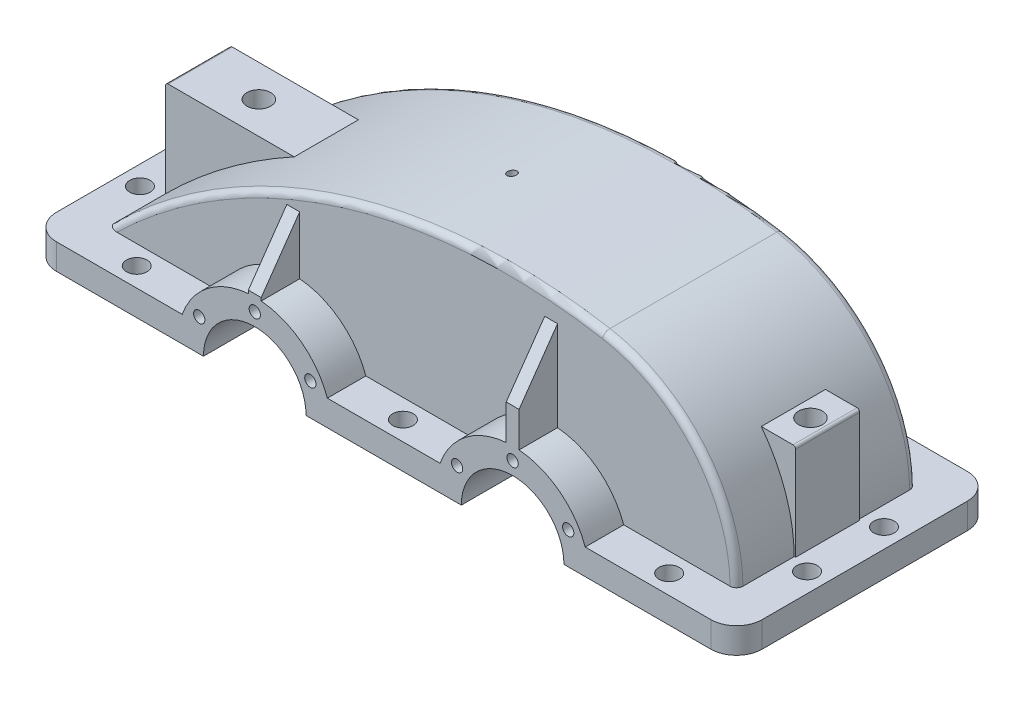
SolidWorks part; units mm, degrees
ref_plane "Front" through (0, 0, 0) normal (0, 0, 1) x (1, 0, 0)
ref_plane "Top" through (0, 0, 0) normal (0, 1, 0) x (1, 0, 0)
ref_plane "Right" through (0, 0, 0) normal (1, 0, 0) x (0, 0, -1)
sketch "Sketch4" plane through (0, 0, 0) normal (0, 0, 1) x (1, 0, 0)
  line L0 (0, 0) -> (490, 0)
  line L1 (0, 0) -> (0, 285.887) construction
  arc A0 (0, 0) -> (386.4319, 122.2359) centre (311.0033, -311.2506) cw
  arc A1 (386.4319, 122.2359) -> (490, 0) centre (365.0033, -0.9137) cw
  dimension "D1" = 440
  dimension "D3" = 125
  dimension "D2" = 490
  dimension "D4" = 54
extrude "Boss-Extrude4" add sketch "Sketch4" along normal blind 140
shell "Shell2" thickness 10
sketch "Sketch6" plane through (0, 0, 0) normal (0, -1, 0) x (1, 0, 0)
  line L0 (0, 0) -> (490, 0) construction
  line L1 (-30, 170) -> (520, 170)
  line L2 (-30, 170) -> (-30, -30)
  line L3 (-30, -30) -> (520, -30)
  line L4 (520, 170) -> (520, -30)
  line L5 (479.9997, 130) -> (479.9997, 10) construction
  line L6 (14.3165, 10) -> (479.9997, 10) construction
  line L7 (14.3165, 130) -> (14.3165, 10) construction
  line L8 (14.3165, 130) -> (479.9997, 130) construction
  line L9 (479.9997, 130) -> (479.9997, 10)
  line L10 (14.3165, 10) -> (479.9997, 10)
  line L11 (14.3165, 130) -> (14.3165, 10)
  line L12 (14.3165, 130) -> (479.9997, 130)
  dimension "D1" = 550
  dimension "D2" = 200
  dimension "D3" = 30
  dimension "D4" = 30
extrude "Boss-Extrude5" add sketch "Sketch6" along normal blind 20
sketch "Sketch7" plane through (0, 0, 170) normal (0, 0, 1) x (1, 0, 0)
  line L0 (520, -20) -> (-30, -20) construction
  line L1 (84.5, -20) -> (104.5, -20)
  line L2 (184.5, -20) -> (204.5, -20)
  line L3 (285.5, -20) -> (305.5, -20)
  line L4 (385.5, -20) -> (405.5, -20)
  arc A0 (204.5, -20) -> (84.5, -20) centre (144.5, -20) ccw
  arc A1 (184.5, -20) -> (104.5, -20) centre (144.5, -20) ccw
  arc A2 (405.5, -20) -> (285.5, -20) centre (345.5, -20) ccw
  arc A3 (385.5, -20) -> (305.5, -20) centre (345.5, -20) ccw
  dimension "D2" = 40
  dimension "D3" = 60
  dimension "D1" = 174.5
  dimension "D4" = 201
extrude "Boss-Extrude6" add sketch "Sketch7" against normal up to next
ref_plane "Plane2" through (0, 0, 70) normal (0, 0, 1) x (1, 0, 0)
mirror "Mirror1" about plane through (0, 0, 70) normal (0, 0, 1) of "Boss-Extrude6"
sketch "Sketch8" plane through (0, 0, 170) normal (0, 0, 1) x (1, 0, 0)
  circle A0 centre (144.5, -20) radius 40
  arc A1 (179.141, 0) -> (109.859, 0) centre (144.5, -20) ccw construction
  circle A2 centre (345.5, -20) radius 40
  arc A3 (380.141, 0) -> (310.859, 0) centre (345.5, -20) ccw construction
extrude "Cut-Extrude2" cut sketch "Sketch8" against normal blind 259
ref_plane "Plane4" through (0, 85, 0) normal (0, -1, 0) x (-1, 0, 0)
sketch "Sketch12" plane through (0, 85, 0) normal (0, -1, 0) x (-1, 0, 0)
  line L0 (-144.5, -170) -> (-144.5, -140) construction
  line L1 (-149.5, 30) -> (-139.5, 30)
  line L2 (-149.5, 30) -> (-149.5, 0)
  line L4 (-139.5, 30) -> (-139.5, 0)
  line L6 (-149.5, -140) -> (-149.5, -170)
  line L7 (-149.5, -170) -> (-139.5, -170)
  line L8 (-139.5, -140) -> (-139.5, -170)
  line L9 (-184.5, -170) -> (-104.5, -170) construction
  line L13 (-104.5, 30) -> (-184.5, 30) construction
  line L14 (-201.0685, -140) -> (-87.9315, -140) construction
  line L15 (-87.9315, 0) -> (-201.0685, 0) construction
  line L16 (-149.5, -140) -> (-139.5, -140)
  line L17 (-139.5, 0) -> (-149.5, 0)
  line L18 (-144.5, 0) -> (-144.5, 118.5487) construction
  dimension "D1" = 10
extrude "Boss-Extrude8" add sketch "Sketch12" along normal up to surface (45.2087 mm away)
ref_plane "Plane5" through (0, 110, 0) normal (0, -1, 0) x (-1, 0, 0)
sketch "Sketch13" plane through (0, 110, 0) normal (0, -1, 0) x (-1, 0, 0)
  line L0 (-345.5, -170) -> (-345.5, -140) construction
  line L1 (-350.5, 30) -> (-340.5, 30)
  line L2 (-350.5, 30) -> (-350.5, 0)
  line L3 (-350.5, -170) -> (-340.5, -170)
  line L4 (-340.5, 30) -> (-340.5, 0)
  line L5 (-385.5, -170) -> (-305.5, -170) construction
  line L6 (-305.5, 30) -> (-385.5, 30) construction
  line L11 (-288.9315, 0) -> (-402.0685, 0) construction
  line L12 (-402.0685, -140) -> (-288.9315, -140) construction
  line L13 (-340.5, 0) -> (-350.5, 0)
  line L14 (-350.5, -140) -> (-340.5, -140)
  line L15 (-340.5, -140) -> (-340.5, -170)
  line L16 (-345.5, 0) -> (-345.5, 30) construction
  line L17 (-350.5, -140) -> (-350.5, -170)
  dimension "D1" = 10
extrude "Boss-Extrude9" add sketch "Sketch13" along normal up to surface (70.2087 mm away)
chamfer "Chamfer1" distance 30 angle 55 4 edges at (144.5, 85, 170) (345.5, 110, 170) (144.5, 85, -30) (345.5, 110, -30)
hole_wizard "Ø16.0mm Dowel Hole1" positions "Sketch15" profile "Sketch16" hole size "Ø16.0" standard "ANSI Metric"
sketch "Sketch15" plane through (0, 0, 0) normal (0, 1, 0) x (1, 0, 0)
  line L1 (-30, -170) -> (-30, 30) construction
  line L2 (87.9315, -170) -> (-30, -170) construction
  line L3 (-30, 30) -> (87.9315, 30) construction
  line L4 (520, 30) -> (520, -170) construction
  point P0 (37.5, 15)
  point P2 (-15, -40)
  point P4 (-15, -100)
  point P6 (37.5, -155)
  point P8 (245, 15)
  point P10 (245, -155)
  point P12 (452.5, 15)
  point P14 (452.5, -155)
  point P16 (505, -40)
  point P18 (505, -100)
  dimension "D1" = 67.5
  dimension "D2" = 60
  dimension "D3" = 15
  dimension "D4" = 275
  dimension "D5" = 70
  dimension "D6" = 15
  dimension "D7" = 15
  dimension "D8" = 67.5
  dimension "D9" = 15
sketch "Sketch16" plane through (37.5, 0, -15) normal (1, 0, 0) x (0, 0, 1)
  line L0 (0, 0) -> (0, 20)
  line L1 (0, 20) -> (8, 20)
  line L2 (8, 20) -> (8, 0)
  line L5 (8, 0) -> (0, 0)
  line L11 (0, -6.35) -> (0, 107.95) construction
  dimension "Thru Hole Dia." = 16
  dimension "Thru Hole Depth" = 20
hole_wizard "M10x1.25 Tapped Hole1" positions "Sketch19" profile "Sketch20" tap size "M10x1.25" standard "ANSI Metric"
sketch "Sketch19" plane through (0, 0, 170) normal (0, 0, 1) x (1, 0, 0)
  line L1 (144.5, -20) -> (144.5, 53.0322) construction
  arc A0 (184.5, -20) -> (104.5, -20) centre (144.5, -20) ccw construction
  point P0 (144.5, 30)
  dimension "D1" = 50
sketch "Sketch20" plane through (144.5, 30, 170) normal (1, 0, 0) x (0, -1, 0)
  line L0 (0, 0) -> (0, 40.001)
  line L1 (0, 40.001) -> (4.4, 40.001)
  line L2 (4.4, 40.001) -> (4.4, 0)
  line L5 (4.4, 0) -> (0, 0)
  line L11 (0, -6.35) -> (0, 107.95) construction
  dimension "Thru Tap Drill Dia." = 8.8
  dimension "Thru Tap Drill Depth" = 40.001
pattern_circular "CirPattern1" count 6 over 360 about axis through (144.5, -20, 0) along (0, 0, 1) of "M10x1.25 Tapped Hole1"
ref_plane "Plane6" through (245, 0, 0) normal (-1, 0, 0) x (0, 0, 1)
mirror "Mirror2" about plane through (245, 0, 0) normal (-1, 0, 0) of "CirPattern1", "M10x1.25 Tapped Hole1"
mirror "Mirror3" about plane through (0, 0, 70) normal (0, 0, 1) of "CirPattern1", "Mirror2", "M10x1.25 Tapped Hole1"
fillet "Fillet1" radius 5 4 edges at (460.3736, 79.8917, 0) (460.3736, 79.8917, 140) (178.3034, 108.2619, 0) (178.3034, 108.2619, 140)
sketch "Sketch21" plane through (0, 0, 70) normal (0, 0, 1) x (1, 0, 0)
  line L0 (464.3115, 75) -> (491, 75)
  line L1 (491, 75) -> (491, 0)
  line L2 (0, 0) -> (0, 75)
  line L3 (0, 75) -> (100.2654, 75)
  line L4 (520, 0) -> (402.0685, 0) construction
  line L5 (490, 0) -> (491, 0)
  arc A0 (490, 0) -> (386.4319, 122.2359) centre (365.0033, -0.9137) ccw construction
  arc A1 (386.4319, 122.2359) -> (0, 0) centre (311.0033, -311.2506) ccw construction
  arc A2 (490, 0) -> (464.3115, 75) centre (365.0033, -0.9137) ccw
  arc A3 (100.2654, 75) -> (0, 0) centre (311.0033, -311.2506) ccw
  dimension "D1" = 75
  dimension "D2" = 491
extrude "Boss-Extrude10" add sketch "Sketch21" along normal mid plane 50
sketch "Sketch22" plane through (0, 75, 0) normal (0, 1, 0) x (1, 0, 0)
  line L1 (491, -95) -> (464.3115, -95) construction
  circle A0 centre (477.6558, -70) radius 10
  circle A1 centre (47.6558, -70) radius 10
  point P6 (477.6558, -95)
  dimension "D1" = 20
  dimension "D2" = 20
  dimension "D3" = 430
  dimension "D4" = 25
hole_wizard "M8x1.0 Tapped Hole1" positions "Sketch23" profile "Sketch25" tap size "M8x1.0" standard "ANSI Metric"
sketch "Sketch23" plane through (0, -20, 0) normal (0, -1, 0) x (-1, 0, 0)
  line L1 (-305.5, -170) -> (-184.5, -170) construction
  line L2 (30, -170) -> (30, 30) construction
  point P0 (-245, -70)
  dimension "D1" = 100
  dimension "D2" = 275
sketch "Sketch25" plane through (245, -20, 70) normal (1, 0, 0) x (0, 0, -1)
  line L0 (0, 0) -> (0, 148.7494)
  line L1 (0, 148.7494) -> (3.5, 148.7494)
  line L2 (3.5, 148.7494) -> (3.5, 0.525)
  line L3 (3.5, 0.525) -> (4.025, 0)
  line L5 (4.025, 0) -> (0, 0)
  line L6 (-3.5, 0.525) -> (-4.025, 0) construction
  line L11 (0, -6.35) -> (0, 107.95) construction
  dimension "Thru Tap Drill Dia." = 7
  dimension "Thru Tap Drill Depth" = 148.7494
  dimension "Near C'Sink Dia." = 8.05
  dimension "Near C'Sink Angle" = 90
fillet "Fillet2" radius 2 2 edges at (491, 75, 70) (0, 75, 70)
fillet "Fillet3" radius 20 4 edges at (520, -10, 170) (520, -10, -30) (-30, -10, -30) (-30, -10, 170)
hole_wizard "M20x1.5 Tapped Hole1" positions "Sketch26" profile "Sketch27" tap size "M20x1.5" standard "ANSI Metric"
sketch "Sketch26" plane through (0, 75, 0) normal (0, 1, 0) x (1, 0, 0)
  point P0 (477.6558, -70)
  point P3 (47.6558, -70)
sketch "Sketch27" plane through (477.6558, 75, 70) normal (1, 0, 0) x (0, 0, 1)
  line L0 (0, 0) -> (0, 25.558)
  line L1 (0, 25.558) -> (9.25, 20)
  line L2 (9.25, 20) -> (9.25, 0)
  line L5 (9.25, 0) -> (0, 0)
  line L10 (0, 25.558) -> (-9.25, 20) construction
  line L11 (0, -6.35) -> (0, 107.95) construction
  dimension "Tap Drill Dia." = 18.5
  dimension "Tap Drill Depth" = 20
  dimension "Drill Angle" = 118
